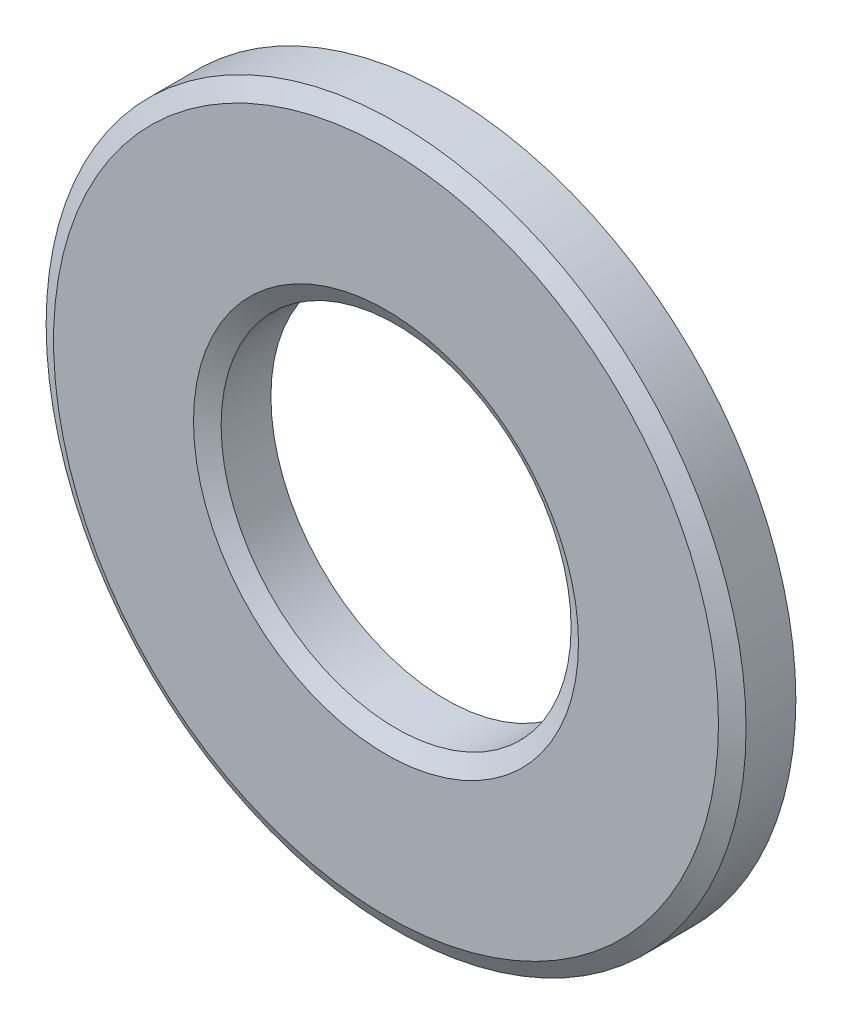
SolidWorks part; units mm, degrees
ref_plane "Plan1" through (0, 0, 0) normal (0, 0, 1) x (1, 0, 0)
ref_plane "Plan2" through (0, 0, 0) normal (0, 1, 0) x (1, 0, 0)
ref_plane "Plan3" through (0, 0, 0) normal (1, 0, 0) x (0, 0, -1)
sketch "Esquisse1" plane through (0, 0, 0) normal (0, 0, 1) x (1, 0, 0)
  circle A0 centre (0, 0) radius 6
  circle A1 centre (0, 0) radius 3
  dimension "D1" = 12
  dimension "D2" = 6
extrude "Base-Extrusion" add sketch "Esquisse1" along normal blind 1.2
chamfer "Chanfrein1" distance 0.3 angle 30 4 edges at (6, 0, 0) (6, 0, 1.2) (3, 0, 0) (3, 0, 1.2)
